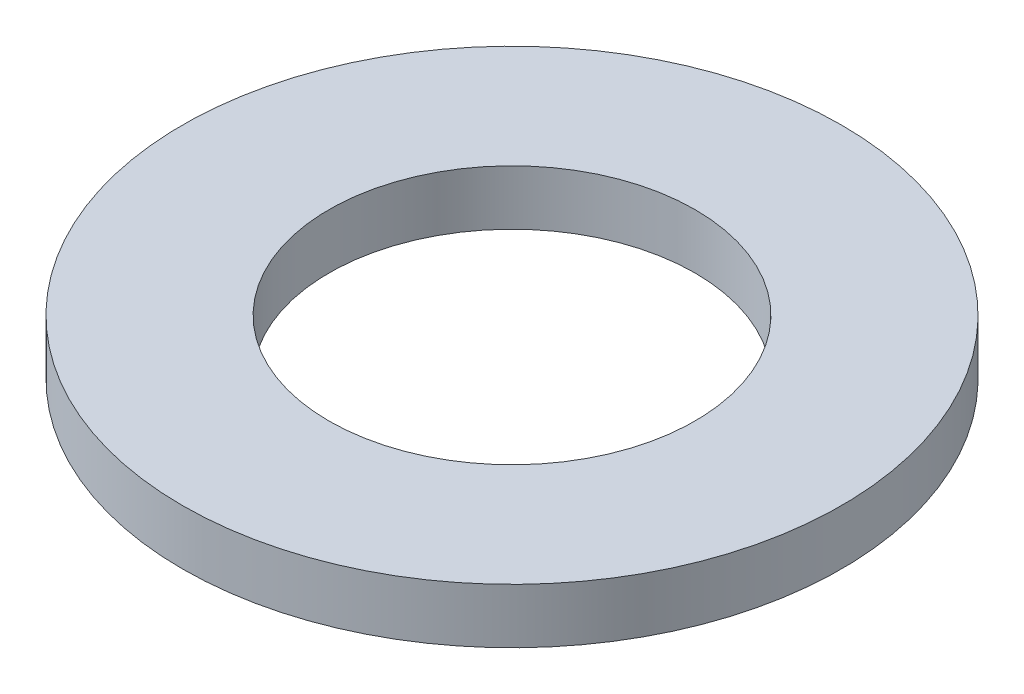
SolidWorks part; units mm, degrees
ref_plane "Front" through (0, 0, 0) normal (0, 0, 1) x (1, 0, 0)
ref_plane "Top" through (0, 0, 0) normal (0, 1, 0) x (1, 0, 0)
ref_plane "Right" through (0, 0, 0) normal (1, 0, 0) x (0, 0, -1)
sketch "Sketch1" plane through (0, 0, 0) normal (0, 1, 0) x (1, 0, 0)
  circle A0 centre (0, 0) radius 20
  circle A1 centre (0, 0) radius 36
extrude "Extrude1" add sketch "Sketch1" along normal blind 6
